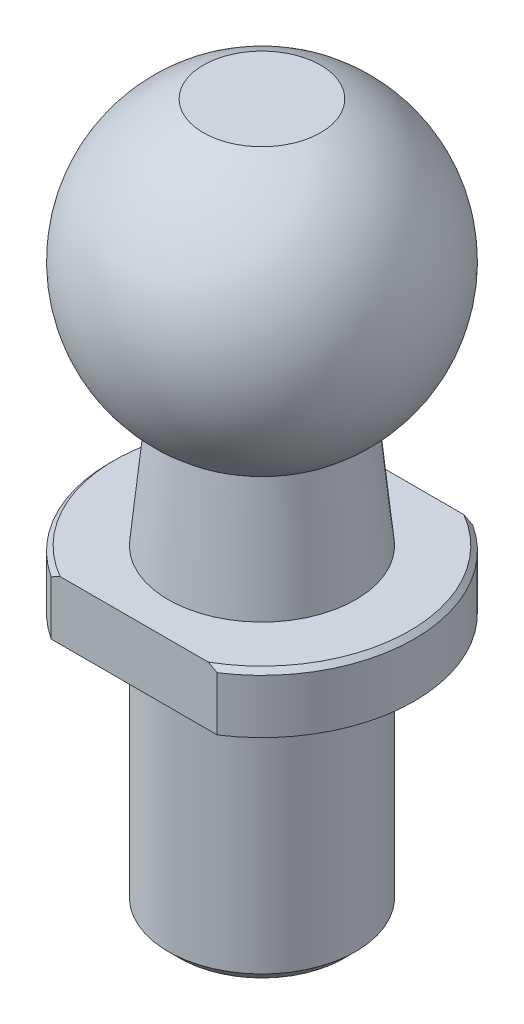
SolidWorks part; units mm, degrees
ref_plane "face" through (0, 0, 0) normal (0, 0, 1) x (1, 0, 0)
ref_plane "coté" through (0, 0, 0) normal (0, 1, 0) x (1, 0, 0)
ref_plane "dessus" through (0, 0, 0) normal (1, 0, 0) x (0, 0, -1)
sketch "Esquisse1" plane through (0, 0, 0) normal (0, 0, 1) x (1, 0, 0)
  line L0 (0, 0) -> (0, 65) construction
  line L1 (0, 0) -> (4, 0)
  line L2 (4, 0) -> (4, 11)
  line L3 (4, 11) -> (6.5, 11)
  line L4 (6.5, 11) -> (6.5, 13.5)
  line L5 (6.5, 13.5) -> (4, 13.5)
  line L6 (4, 13.5) -> (3.5, 18.5228)
  line L7 (0, 0) -> (0, 30)
  line L8 (0, 30) -> (2.5, 30)
  arc A0 (3.5, 18.5228) -> (2.5, 30) centre (0, 24) ccw
  dimension "D1" = 6.5
  dimension "D2" = 3.5
  dimension "D3" = 6
  dimension "D4" = 4
  dimension "D5" = 11
  dimension "D6" = 2.5
  dimension "D7" = 10.5
revolve "Base-Révolution" add sketch "Esquisse1" angle 360 about L0
chamfer "Chanfrein1" distance 0.5 angle 45
sketch "Esquisse2" plane through (0, 11, 0) normal (0, -1, 0) x (1, 0, 0)
  line L0 (-3.5422, 5.45) -> (3.5422, 5.45)
  line L1 (-3.5422, -5.45) -> (3.5422, -5.45)
  arc A0 (3.5422, 5.45) -> (-3.5422, 5.45) centre (0, 0) ccw
  circle A1 centre (0, 0) radius 6.5
  arc A2 (-3.5422, -5.45) -> (3.5422, -5.45) centre (0, 0) ccw
  dimension "D2" = 5.45
  dimension "D3" = 5.45
  dimension "D1" = 0
extrude "Enlèv. mat.-Extru.1" cut sketch "Esquisse2" against normal up to next
chamfer "Chanfrein2" distance 0.2 angle 45
